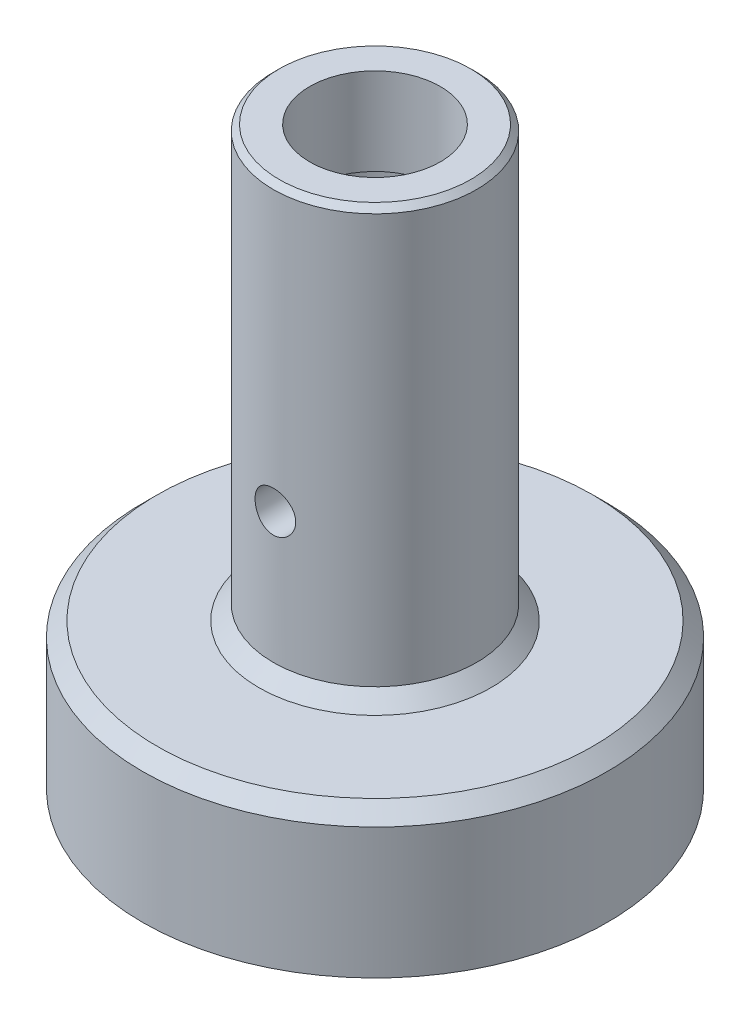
SolidWorks part; units mm, degrees
ref_plane "Plan de face" through (0, 0, 0) normal (0, 0, 1) x (1, 0, 0)
ref_plane "Plan de dessus" through (0, 0, 0) normal (0, 1, 0) x (1, 0, 0)
ref_plane "Plan de droite" through (0, 0, 0) normal (1, 0, 0) x (0, 0, -1)
sketch "Esquisse1" plane through (0, 0, 0) normal (0, 0, 1) x (1, 0, 0)
  line L0 (35, -158) -> (35, -178)
  line L1 (22.5, 0) -> (35, 0)
  line L2 (25, -30) -> (25, -178)
  line L3 (25, -178) -> (35, -178)
  line L4 (35, 0) -> (35, -148)
  line L5 (35, -148) -> (80, -148)
  line L6 (0, 66.7925) -> (0, -157.124) construction
  line L7 (35, -158) -> (77, -158)
  line L10 (80, -148) -> (80, -198)
  line L11 (80, -198) -> (77, -198)
  line L12 (77, -158) -> (77, -198)
  line L15 (25, -30) -> (22.5, -30)
  line L16 (22.5, 0) -> (22.5, -30)
  dimension "D1" = 45
  dimension "D2" = 148
  dimension "D3" = 50
  dimension "D4" = 178
  dimension "D5" = 50
  dimension "D6" = 30
  dimension "D7" = 70
  dimension "D8" = 3
  dimension "D9" = 80
  dimension "D10" = 10
revolve "Révolution1" add sketch "Esquisse1" angle 360 about L6
chamfer "Chanfrein1" distance 5 angle 45 1 edges at (0, -148, 80)
chamfer "Chanfrein2" distance 5 angle 45 1 edges at (0, -148, 35)
chamfer "Chanfrein3" distance 2 angle 45 2 edges at (0, -178, 25) (0, 0, 35)
sketch "Esquisse2" plane through (0, 0, 0) normal (0, 0, 1) x (1, 0, 0)
  line L0 (-35, -178) -> (35, -178) construction
  circle A0 centre (0, -98) radius 7
  dimension "D1" = 14
  dimension "D2" = 80
extrude "Enlèv. mat.-Extru.1" cut sketch "Esquisse2" along normal through all
